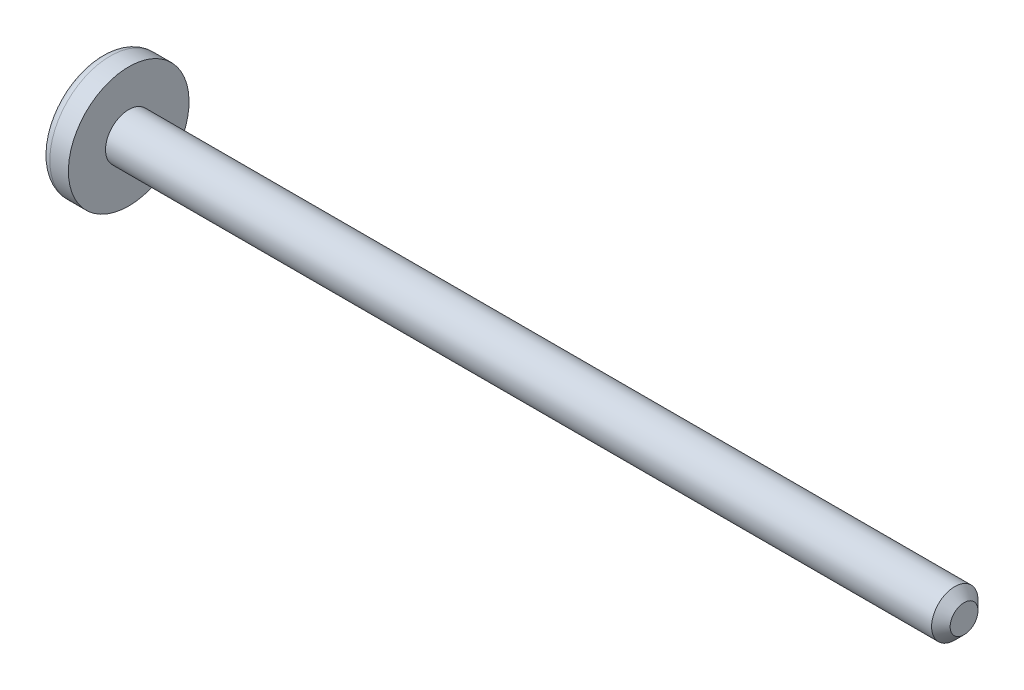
SolidWorks part; units mm, degrees
ref_plane "Plan de face" through (0, 0, 0) normal (0, 0, 1) x (1, 0, 0)
ref_plane "Plan de dessus" through (0, 0, 0) normal (0, 1, 0) x (1, 0, 0)
ref_plane "Plan de droite" through (0, 0, 0) normal (1, 0, 0) x (0, 0, -1)
ref_plane "Plan4" through (0, 0, 0) normal (0, 0, -1) x (-1, 0, 0)
sketch "Esquisse1" plane through (0, 0, 0) normal (0, 0, -1) x (-1, 0, 0)
  line L0 (-186, 5) -> (-186, 0)
  line L1 (0, 0) -> (-186, 0)
  line L3 (-6, 5) -> (-186, 5)
  line L4 (-186, 0) -> (0, 0) construction
  line L5 (0, 0) -> (0, 13)
  line L6 (0, 13) -> (-6, 13)
  line L7 (-6, 13) -> (-6, 5)
  dimension "D1" = 180
  dimension "D2" = 5
  dimension "D4" = 6
  dimension "D5" = 13
revolve "Révolution1" add sketch "Esquisse1" angle 360 about L4
fillet "Congé1" radius 2 1 edges at (0, -13, 0)
chamfer "Chanfrein1" distance 2 angle 45 1 edges at (186, -5, 0)
